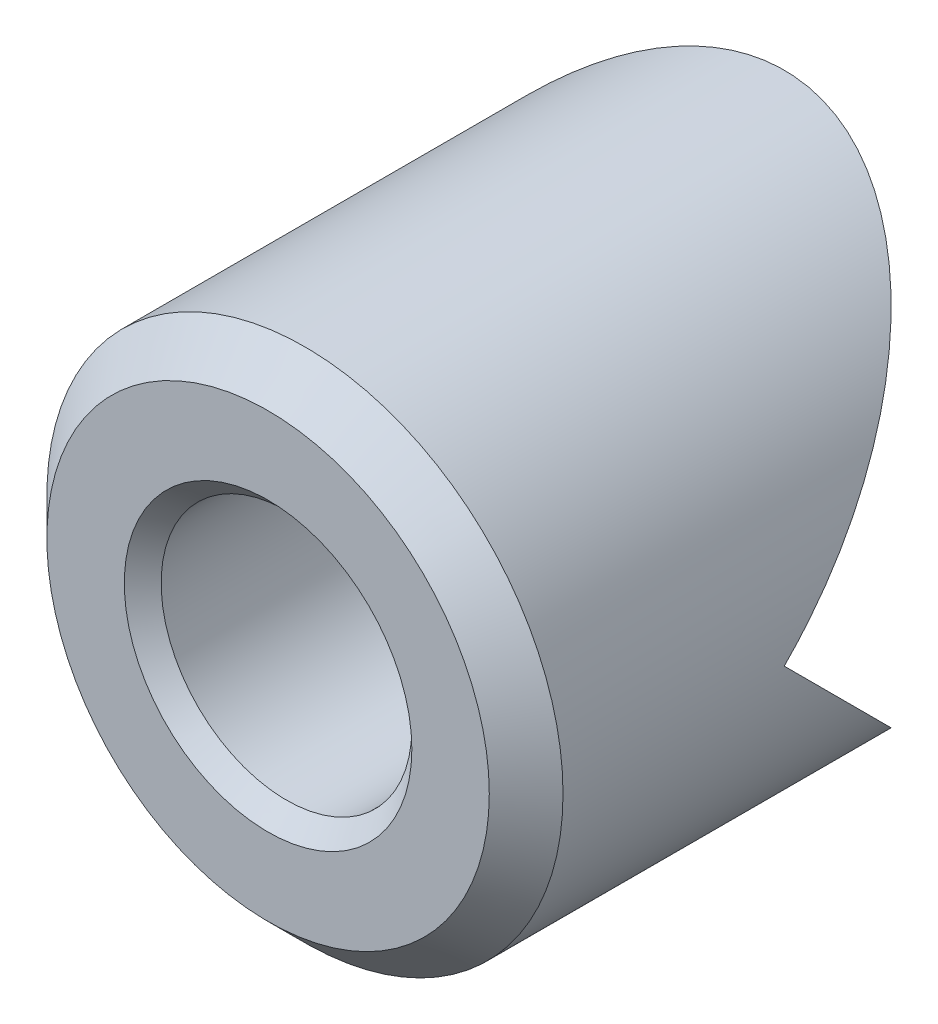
SolidWorks part; units mm, degrees
ref_plane "Plan de face" through (0, 0, 0) normal (0, 0, 1) x (1, 0, 0)
ref_plane "Plan de dessus" through (0, 0, 0) normal (0, 1, 0) x (1, 0, 0)
ref_plane "Plan de droite" through (0, 0, 0) normal (1, 0, 0) x (0, 0, -1)
sketch "Esquisse1" plane through (0, 0, 0) normal (0, 0, 1) x (1, 0, 0)
  circle A0 centre (0, 0) radius 7
  dimension "D1" = 14
extrude "Boss.-Extru.1" add sketch "Esquisse1" along normal blind 14
chamfer "Chanfrein1" distance 1 angle 45 1 edges at (7, 0, 14)
sketch "Esquisse2" plane through (0, 0, 0) normal (1, 0, 0) x (0, 0, -1)
  line L0 (0, 7) -> (-7, 0)
  line L1 (-7, 0) -> (0, -7)
  dimension "D1" = 90
extrude "Enlèv. mat.-Extru.1" cut sketch "Esquisse2" against normal through all and the other way through all
hole_wizard "Trou taraudé M81" positions "Esquisse4" profile "Esquisse3" tap size "M8" standard "ISO"
sketch "Esquisse4" plane through (0, 0, 14) normal (0, 0, 1) x (1, 0, 0)
  point P0 (0, 0)
sketch "Esquisse3" plane through (0, 0, 14) normal (1, 0, 0) x (0, -1, 0)
  line L0 (0, 0) -> (0, 14)
  line L1 (0, 14) -> (3.4, 14)
  line L2 (3.4, 14) -> (3.4, 0)
  line L5 (3.4, 0) -> (0, 0)
  line L11 (0, -6.35) -> (0, 107.95) construction
  dimension "Diamètre du trou pour taraudage jusqu'au prochain" = 6.8
  dimension "Profondeur du trou pour taraudage jusqu'au prochain" = 14
chamfer "Chanfrein2" distance 0.5 angle 45 1 edges at (3.4, 0, 14)
